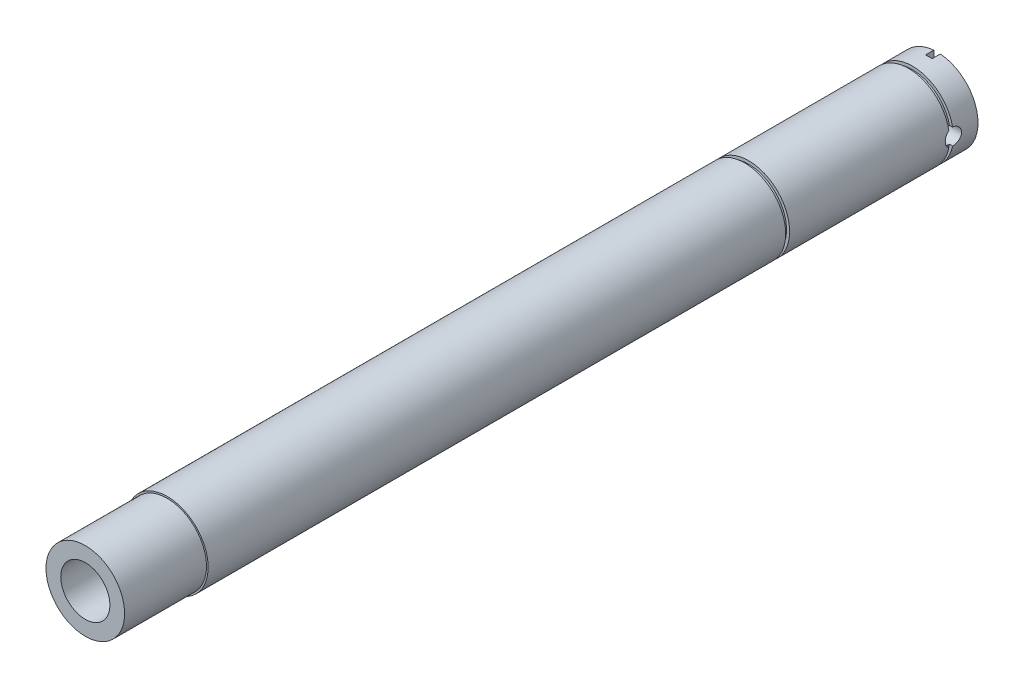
SolidWorks part; units mm, degrees
ref_plane "Front Plane" through (0, 0, 0) normal (0, 0, 1) x (1, 0, 0)
ref_plane "Top Plane" through (0, 0, 0) normal (0, 1, 0) x (1, 0, 0)
ref_plane "Right Plane" through (0, 0, 0) normal (1, 0, 0) x (0, 0, -1)
sketch "Sketch1" plane through (0, 0, 0) normal (0, 1, 0) x (1, 0, 0)
  line L0 (-15.875, 194.3195) -> (-15.875, -29.5815)
  line L1 (-15.875, 268.8685) -> (-9.525, 268.8685)
  line L2 (-15.875, 268.8685) -> (-15.875, 259.3435)
  line L3 (-15.24, -61.3315) -> (-9.525, -61.3315)
  line L4 (-9.525, 268.8685) -> (-9.525, -61.3315)
  line L5 (-15.875, -29.5815) -> (-15.24, -29.5815)
  line L6 (0, 317.2647) -> (0, -85.4283) construction
  line L7 (-15.875, 195.8435) -> (-14.6812, 195.8435)
  line L9 (-15.875, 257.8195) -> (-15.875, 195.8435)
  line L10 (-15.875, 259.3435) -> (-14.6812, 259.3435)
  line L11 (-15.24, -29.5815) -> (-15.24, -61.3315)
  line L12 (-15.875, 257.8195) -> (-14.6812, 257.8195)
  line L13 (-14.6812, 259.3435) -> (-14.6812, 257.8195)
  line L14 (-15.875, 194.3195) -> (-14.6812, 194.3195)
  line L15 (-14.6812, 195.8435) -> (-14.6812, 194.3195)
  dimension "D1" = 330.2
  dimension "D2" = 31.75
  dimension "D3" = 15.24
  dimension "D4" = 15.875
  dimension "D5" = 6.35
  dimension "D6" = 9.525
  dimension "D7" = 1.524
  dimension "D8" = 1.1938
  dimension "D9" = 63.5
  dimension "D10" = 1.524
revolve "Revolve1" add sketch "Sketch1" angle 360 about L6
sketch "Sketch2" plane through (0, 0, 0) normal (0, 1, 0) x (1, 0, 0)
  line L0 (0, -55) -> (0, 55) construction
  line L1 (-1.27, 272.0435) -> (1.27, 272.0435)
  line L2 (-1.27, 272.0435) -> (-1.27, 265.6935)
  line L3 (-1.27, 265.6935) -> (1.27, 265.6935)
  line L4 (1.27, 272.0435) -> (1.27, 265.6935)
  line L5 (15.875, 268.8685) -> (-15.875, 268.8685) construction
  point P4 (0, 272.0435)
  dimension "D1" = 2.54
  dimension "D2" = 6.35
  dimension "D3" = 3.175
extrude "Cut-Extrude1" cut sketch "Sketch2" against normal through all and the other way through all
hole_wizard "1/4 (0.25) Diameter Hole1" positions "3DSketch1" profile "Sketch3" hole size "1/4" standard "Ansi Inch"
sketch3d "3DSketch1"
  point P0 (-15.875, 0, -259.3435)
  dimension "D1" = 9.525
sketch "Sketch3" plane through (-15.875, 0, -259.3435) normal (0, 1, 0) x (0, 0, 1)
  line L0 (0, 0) -> (0, 31.75)
  line L1 (0, 31.75) -> (3.175, 31.75)
  line L2 (3.175, 31.75) -> (3.175, 0)
  line L5 (3.175, 0) -> (0, 0)
  line L11 (0, -6.35) -> (0, 107.95) construction
  dimension "Thru Hole Dia." = 6.35
  dimension "Thru Hole Depth" = 31.75
